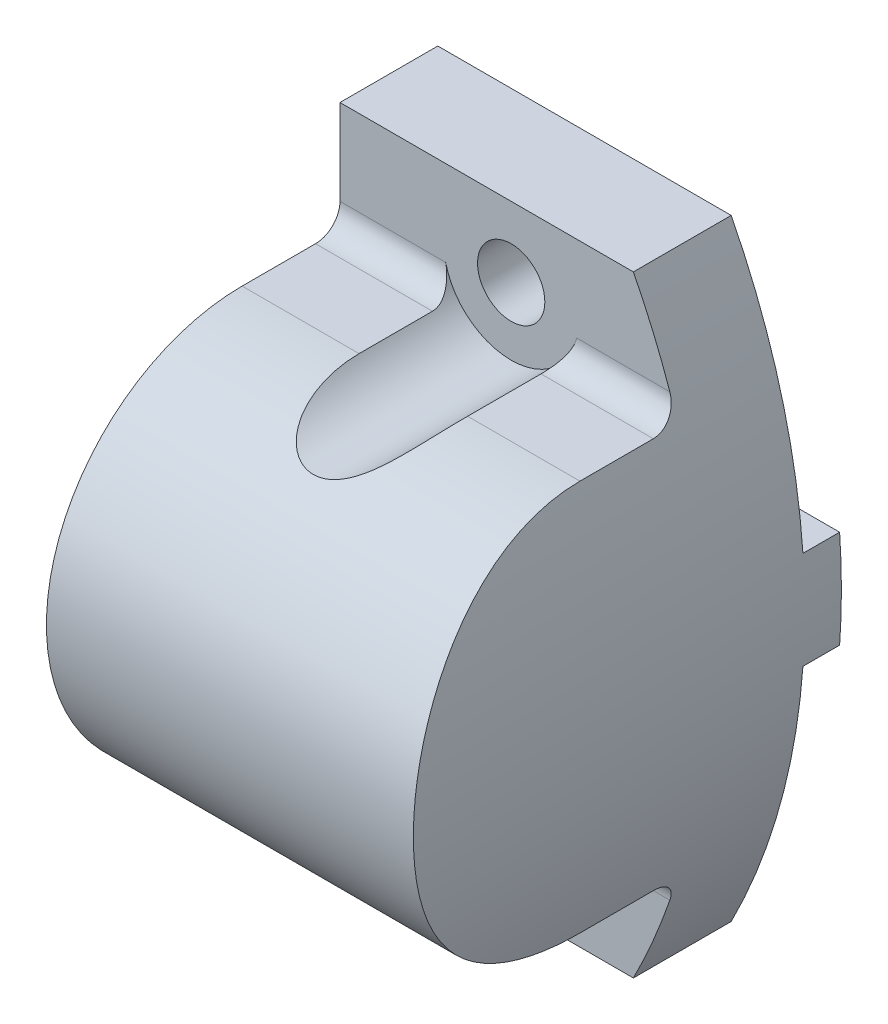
SolidWorks part; units mm, degrees
ref_plane "Face" through (0, 0, 0) normal (0, 0, 1) x (1, 0, 0)
ref_plane "Dessus" through (0, 0, 0) normal (0, 1, 0) x (1, 0, 0)
ref_plane "Droite" through (0, 0, 0) normal (1, 0, 0) x (0, 0, -1)
sketch "Esquisse1" plane through (0, 0, 0) normal (0, 0, 1) x (1, 0, 0)
  line L0 (48.9898, 25) -> (25, 25)
  line L1 (25, 25) -> (25, -25)
  line L2 (25, -25) -> (48.9898, -25)
  arc A0 (48.9898, -25) -> (48.9898, 25) centre (0, 0) ccw
  dimension "D1" = 110
  dimension "D2" = 25
  dimension "D3" = 50
  dimension "D4" = 25
extrude "Extrusion1" add sketch "Esquisse1" along normal blind 32
sketch "Esquisse2" plane through (25, 0, 0) normal (-1, 0, 0) x (0, 0, 1)
  line L0 (32, 25) -> (32, -25) construction
  line L1 (16, -16) -> (10, -16)
  line L2 (8, -18) -> (8, -25)
  line L3 (32, -25) -> (0, -25) construction
  line L4 (0, 25) -> (0, -25) construction
  line L5 (16, 16) -> (10, 16)
  line L6 (8, 18) -> (8, 25)
  line L7 (32, 25) -> (0, 25) construction
  line L8 (37, 25) -> (37, -25)
  line L12 (0, 25) -> (0, -25)
  line L13 (0, -25) -> (32, -25)
  line L14 (32, -25) -> (32, 25)
  line L15 (32, 25) -> (0, 25)
  line L17 (8, -25) -> (37, -25)
  line L19 (37, 25) -> (8, 25)
  arc A0 (16, -16) -> (16, 16) centre (16, 0) ccw
  arc A1 (10, -16) -> (8, -18) centre (10, -18) ccw
  arc A2 (10, 16) -> (8, 18) centre (10, 18) cw
  dimension "D1" = 32
  dimension "D8" = 2
  dimension "D2" = 8
  dimension "D3" = 8
  dimension "D4" = 16
  dimension "D5" = 16
  dimension "D7" = 5
  dimension "D6" = 0
extrude "Enlèv. mat.-Extru.2" cut sketch "Esquisse2" against normal through all
sketch "Esquisse3" plane through (25, 0, 0) normal (-1, 0, 0) x (0, 0, 1)
  line L0 (0, 25) -> (0, -25) construction
  line L1 (4, 4) -> (-3, 4)
  line L2 (4, 4) -> (4, -4)
  line L3 (4, -4) -> (-3, -4)
  line L4 (-3, 4) -> (-3, -4)
  dimension "D1" = 8
  dimension "D2" = 4
  dimension "D3" = 3
  dimension "D4" = 4
extrude "Extrusion2" add sketch "Esquisse3" against normal up to surface (29.8544 mm away)
sketch "Esquisse4" plane through (25, 0, 0) normal (-1, 0, 0) x (0, 0, 1)
  circle A0 centre (16, 0) radius 10
  arc A1 (16, -16) -> (16, 16) centre (16, 0) ccw construction
  dimension "D1" = 20
extrude "Enlèv. mat.-Extru.3" cut sketch "Esquisse4" against normal blind 25
sketch "Esquisse5" plane through (0, 0, 8) normal (0, 0, 1) x (1, 0, 0)
  line L0 (25, 25) -> (25, 18) construction
  line L1 (25, 16) -> (25, -16) construction
  circle A0 centre (39, -19.25) radius 2.75
  circle A1 centre (39, 19.25) radius 2.75
  dimension "D1" = 5.5
  dimension "D2" = 5.5
  dimension "D6" = 14
  dimension "D3" = 19.25
  dimension "D4" = 19.25
  dimension "D5" = 14
extrude "Enlèv. mat.-Extru.4" cut sketch "Esquisse5" against normal through all
sketch "Esquisse6" plane through (0, 0, 8) normal (0, 0, 1) x (1, 0, 0)
  circle A0 centre (39, 19.25) radius 5.5
  circle A1 centre (39, -19.25) radius 5.5
  dimension "D1" = 11
  dimension "D2" = 11
extrude "Enlèv. mat.-Extru.5" cut sketch "Esquisse6" along normal through all
